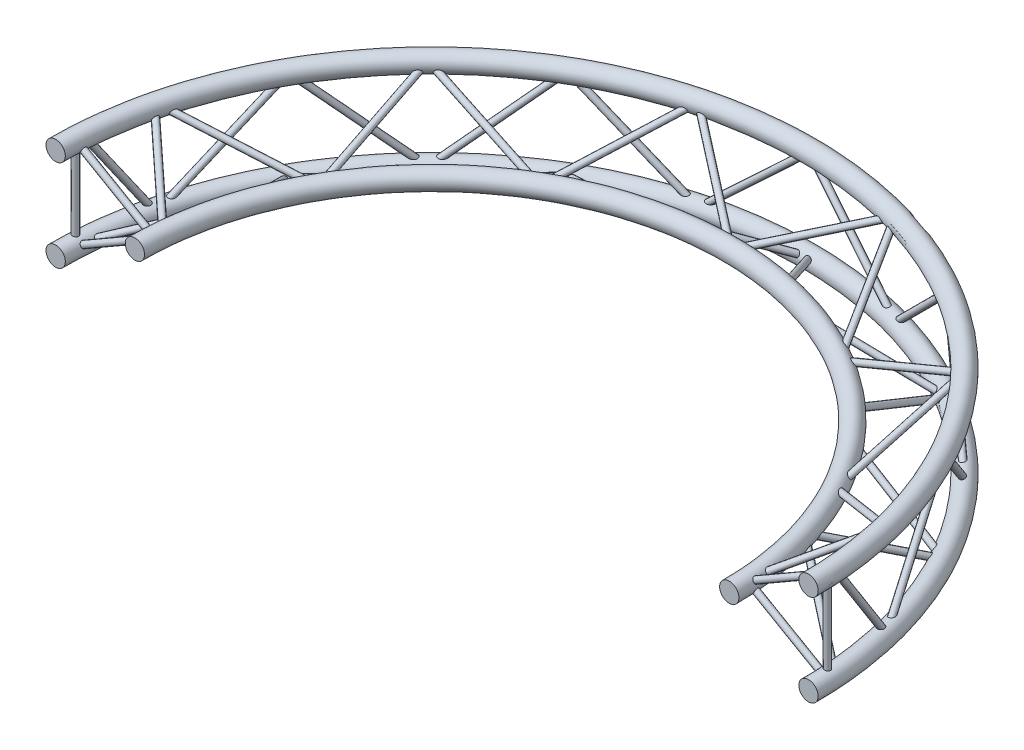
SolidWorks part; units mm, degrees
ref_plane "Face" through (0, 0, 0) normal (0, 0, 1) x (1, 0, 0)
ref_plane "Dessus" through (0, 0, 0) normal (0, 1, 0) x (1, 0, 0)
ref_plane "Droite" through (0, 0, 0) normal (1, 0, 0) x (0, 0, -1)
sketch "Esquisse1" plane through (0, 0, 0) normal (0, 0, 1) x (1, 0, 0)
  line L0 (975, 118.5) -> (769.752, 0) construction
  line L1 (769.752, 0) -> (975, -118.5) construction
  line L2 (975, -118.5) -> (975, 118.5) construction
  line L3 (906.584, 61.5908) -> (906.584, -61.5908) construction
  line L4 (72.9361, 0) -> (1740.2318, 0) construction
  line L5 (906.584, 0) -> (975, 118.5)
  line L8 (1000, -118.5) -> (1000, 157.8926) construction
  line L9 (0, 252.4415) -> (0, -235.2114) construction
  circle A0 centre (906.584, 0) radius 136.832 construction
  circle A1 centre (975, 118.5) radius 25
  circle A2 centre (769.752, 0) radius 25
  circle A3 centre (975, -118.5) radius 25
  dimension "D1" = 60
  dimension "D2" = 50
  dimension "D3" = 237
  dimension "D4" = 1000
revolve "Révolution1" add sketch "Esquisse1" angle 180 about L9
ref_point "Point1"
ref_plane "Plan1" through (0, 0, 0) normal (0, 1, 0) x (-1, 0, 0)
sketch "cercle1" plane through (0, 0, 0) normal (0, 1, 0) x (-1, 0, 0)
  circle A0 centre (0, 0) radius 769.752
ref_point "Point2"
ref_plane "Plan2" through (0, -118.5, 0) normal (0, 1, 0) x (-1, 0, 0)
sketch "cercle2" plane through (0, -118.5, 0) normal (0, 1, 0) x (-1, 0, 0)
  circle A0 centre (0, 0) radius 975
ref_point "Point3"
ref_plane "Plan3" through (0, 118.5, 0) normal (0, 1, 0) x (-1, 0, 0)
sketch "cercle3" plane through (0, 118.5, 0) normal (0, 1, 0) x (-1, 0, 0)
  circle A0 centre (0, 0) radius 975
ref_point "Point4"
ref_plane "Plan4" through (0, 0, 0) normal (0, 1, 0) x (-1, 0, 0)
sketch "cercle4" plane through (0, 0, 0) normal (0, 1, 0) x (-1, 0, 0)
  circle A0 centre (0, 0) radius 906.584
ref_plane "plan_sym" through (0, 0, 0) normal (1, 0, 0) x (0, 0, -1)
sketch3d "Esquisse3D1"
  line L0 (973.7179, 118.5, -49.9836) -> (768.1268, 0, -49.9934)
  line L1 (768.1268, 0, -49.9934) -> (973.7179, -118.5, -49.9836)
  line L2 (973.7179, -118.5, -49.9836) -> (973.7179, 118.5, -49.9836)
  line L3 (769.752, 0, 0) -> (975, -118.5, 0) construction
  circle A0 centre (0, 118.5, 0) radius 975 construction
  circle A1 centre (0, 0, 0) radius 769.752 construction
  circle A2 centre (0, -118.5, 0) radius 975 construction
  circle A3 centre (975, 118.5, 0) radius 25 construction
  point P4 (0, 1093.5, 0)
  point P7 (0, 769.752, 0)
  point P11 (0, 856.5, 0)
  point P14 (975, 118.5, 25)
  dimension "D1" = 50
  dimension "D2" = 50
  dimension "D3" = 50
ref_plane "Plan6" through (768.1268, 0, -49.9934) normal (-0.8664, -0.4994, 0) x (0.4994, -0.8664, -0.0001)
sketch "Esquisse8" plane through (768.1268, 0, -49.9934) normal (-0.8664, -0.4994, 0) x (0.4994, -0.8664, -0.0001)
  circle A0 centre (0, 0) radius 8
sweep "treilli droit départ" add profiles "Esquisse8" path "Esquisse3D1"
mirror "treilli droit fin" about plane through (0, 0, 0) normal (1, 0, 0) of "treilli droit départ"
sketch3d "Esquisse3D2"
  line L0 (972.4872, -118.5, -69.9549) -> (734.5482, 0, -230.1241)
  line L1 (769.752, 0, 0) -> (975, -118.5, 0) construction
  circle A0 centre (0, -118.5, 0) radius 975 construction
  circle A1 centre (0, 0, 0) radius 769.752 construction
  point P4 (0, 856.5, 0)
  point P7 (0, 769.752, 0)
  dimension "D1" = 70
  dimension "D2" = 230.7963
ref_plane "Plan7" through (734.5482, 0, -230.1241) normal (-0.7667, 0.3818, -0.5161) x (-0.5576, 0.0022, 0.8301)
sketch "Esquisse9" plane through (734.5482, 0, -230.1241) normal (-0.7667, 0.3818, -0.5161) x (-0.5576, 0.0022, 0.8301)
  circle A0 centre (0, 0) radius 8
  dimension "D1" = 16
sweep "treilli depart 1" add profiles "Esquisse9" path "Esquisse3D2"
sketch3d "Esquisse3D3"
  line L0 (766.5691, 0, -69.9276) -> (947.6836, 118.5, -229.1741)
  circle A0 centre (0, 0, 0) radius 769.752 construction
  circle A1 centre (0, 118.5, 0) radius 975 construction
  point P4 (0, 769.752, 0)
  point P7 (0, 1093.5, 0)
  dimension "D1" = 70
  dimension "D2" = 230.7963
ref_plane "Plan8" through (766.5691, 0, -69.9276) normal (0.674, 0.441, -0.5926) x (-0.7281, 0.5323, -0.4319)
sketch "Esquisse10" plane through (766.5691, 0, -69.9276) normal (0.674, 0.441, -0.5926) x (-0.7281, 0.5323, -0.4319)
  circle A0 centre (0, 0) radius 8
  dimension "D1" = 16
sweep "treilli depart 2" add profiles "Esquisse10" path "Esquisse3D3"
sketch3d "Esquisse3D4"
  line L0 (972.4872, 118.5, -69.9549) -> (947.6836, -118.5, -229.1741)
  circle A0 centre (0, 118.5, 0) radius 975 construction
  circle A1 centre (0, -118.5, 0) radius 975 construction
  point P4 (0, 1093.5, 0)
  point P7 (0, 856.5, 0)
  dimension "D1" = 230.7963
  dimension "D2" = 70
ref_plane "Plan9" through (947.6836, -118.5, -229.1741) normal (-0.0865, -0.827, -0.5556) x (0.9956, -0.0518, -0.0781)
sketch "Esquisse11" plane through (947.6836, -118.5, -229.1741) normal (-0.0865, -0.827, -0.5556) x (0.9956, -0.0518, -0.0781)
  circle A0 centre (0, 0) radius 8
  dimension "D1" = 16
sweep "treilli depart 3" add profiles "Esquisse11" path "Esquisse3D4"
mirror "treillis fin" about plane through (0, 0, 0) normal (1, 0, 0) of "treilli depart 1", "treilli depart 2", "treilli depart 3"
sketch3d "Esquisse3D6"
  line L0 (947.6836, 118.5, -229.1741) -> (674.3665, 0, -371.1441)
  line L1 (927.0673, 105.0111, -211.047) -> (785.4341, 12.343, -86.5148) construction
  circle A0 centre (0, 118.5, 0) radius 975 construction
  circle A1 centre (0, 0, 0) radius 769.752 construction
  point P4 (0, 1093.5, 0)
  point P7 (0, 769.752, 0)
  dimension "D1" = 330
ref_plane "Plan11" through (674.3665, 0, -371.1441) normal (-0.8282, -0.3591, -0.4302) x (0.5565, -0.6174, -0.556)
sketch "Esquisse12" plane through (674.3665, 0, -371.1441) normal (-0.8282, -0.3591, -0.4302) x (0.5565, -0.6174, -0.556)
  circle A0 centre (0, 0) radius 8
  dimension "D1" = 16
sweep "treilli int 1" add profiles "Esquisse12" path "Esquisse3D6"
ref_plane "Plan10" through (0, 0, 0) normal (0.4822, 0, 0.8761) x (0.8761, 0, -0.4822)
sketch3d "Esquisse3D7"
  line L2 (947.4717, -118.5, -230.0487) -> (854.1807, 118.5, -470.1066)
  circle A0 centre (0, 118.5, 0) radius 975 construction
  circle A1 centre (0, -118.5, 0) radius 975 construction
  point P4 (0, 1093.5, 0)
  point P5 (0, 856.5, 0)
  dimension "D1" = 350
ref_plane "Plan12" through (854.1807, 118.5, -470.1066) normal (-0.2665, 0.6771, -0.6859) x (-0.9638, -0.1787, 0.1981)
sketch "Esquisse13" plane through (854.1807, 118.5, -470.1066) normal (-0.2665, 0.6771, -0.6859) x (-0.9638, -0.1787, 0.1981)
  circle A0 centre (0, 0) radius 8
  dimension "D1" = 16
sweep "treilli int 2" add profiles "Esquisse13" path "Esquisse3D7"
sketch3d "Esquisse3D9"
  line L0 (734.5482, 0, -230.1241) -> (854.1807, -118.5, -470.1066)
  line L1 (953.3141, -108.9513, -82.8613) -> (767.6169, -16.4691, -207.8639) construction
  circle A0 centre (0, 0, 0) radius 769.752 construction
  circle A1 centre (0, -118.5, 0) radius 975 construction
  point P4 (0, 769.752, 0)
  point P7 (0, 856.5, 0)
  dimension "D1" = 293.1652
ref_plane "Plan13" through (734.5482, 0, -230.1241) normal (0.4081, -0.4042, -0.8186) x (-0.8857, 0.0423, -0.4624)
sketch "Esquisse14" plane through (734.5482, 0, -230.1241) normal (0.4081, -0.4042, -0.8186) x (-0.8857, 0.0423, -0.4624)
  circle A0 centre (0, 0) radius 8
  dimension "D1" = 16
sweep "treilli int 3" add profiles "Esquisse14" path "Esquisse3D9"
sketch3d "Esquisse3D10"
  line L0 (700.6628, 118.5, -678.0093) -> (674.3665, 0, -371.1441)
  circle A0 centre (0, 118.5, 0) radius 975 construction
  circle A1 centre (0, 0, 0) radius 769.752 construction
  point P4 (0, 1093.5, 0)
  point P7 (0, 769.752, 0)
  dimension "D1" = 330
ref_plane "Plan14" through (700.6628, 118.5, -678.0093) normal (-0.0797, -0.3591, 0.9299) x (0.996, 0.0091, 0.0888)
sketch "Esquisse15" plane through (700.6628, 118.5, -678.0093) normal (-0.0797, -0.3591, 0.9299) x (0.996, 0.0091, 0.0888)
  circle A0 centre (0, 0) radius 8
  dimension "D1" = 16
sweep "treilli int4" add profiles "Esquisse15" path "Esquisse3D10"
sketch3d "Esquisse3D11"
  line L0 (854.1807, 118.5, -470.1066) -> (701.2883, -118.5, -677.3623)
  circle A0 centre (0, -118.5, 0) radius 975 construction
  point P5 (0, 856.5, 0)
  dimension "D1" = 350
ref_plane "Plan15" through (701.2883, -118.5, -677.3623) normal (-0.4368, -0.6771, -0.5922) x (-0.8972, 0.3752, 0.2328)
sketch "Esquisse16" plane through (701.2883, -118.5, -677.3623) normal (-0.4368, -0.6771, -0.5922) x (-0.8972, 0.3752, 0.2328)
  circle A0 centre (0, 0) radius 8
  dimension "D1" = 16
sweep "treilli int 5" add profiles "Esquisse16" path "Esquisse3D11"
sketch3d "Esquisse3D12"
  line L0 (854.1807, -118.5, -470.1066) -> (587.429, 0, -497.4388)
  circle A0 centre (0, 0, 0) radius 769.752 construction
  point P5 (0, 769.752, 0)
  dimension "D1" = 293.1652
ref_plane "Plan16" through (854.1807, -118.5, -470.1066) normal (-0.9099, 0.4042, -0.0932) x (-0.1406, -0.0891, 0.986)
sketch "Esquisse17" plane through (854.1807, -118.5, -470.1066) normal (-0.9099, 0.4042, -0.0932) x (-0.1406, -0.0891, 0.986)
  circle A0 centre (0, 0) radius 8
  dimension "D1" = 16
sweep "treilli int 6" add profiles "Esquisse17" path "Esquisse3D12"
sketch "Esquisse19" plane through (0, 0, 0) normal (0, 1, 0) x (1, 0, 0)
  line L0 (674.3665, 371.1441) -> (0, 0)
  line L1 (0, 0) -> (947.6836, 229.1741)
  line L2 (927.0673, 211.047) -> (785.4341, 86.5148) construction
  line L3 (-234.9734, -129.3199) -> (234.9734, 129.3199) construction
  line L4 (926.5748, 240.1387) -> (713.6413, 350.7435) construction
  circle A1 centre (0, 0) radius 769.752 construction
  circle A2 centre (0, 0) radius 975 construction
  dimension "D1" = 15.232
pattern_circular "Répétition circulaire1" count 5 every 30.464 of "treilli int 1", "treilli int 3", "treilli int 2"
pattern_circular "Répétition circulaire2" count 5 every 30.464 of "treilli int4", "treilli int 6", "treilli int 5"
sketch3d "Esquisse3D13"
  line L0 (-972.4839, 118.5, -70) -> (-734.3372, 0, -230.7963)
  circle A0 centre (0, 118.5, 0) radius 975 construction
  circle A1 centre (0, 0, 0) radius 769.752 construction
  point P4 (0, 1093.5, 0)
  point P7 (0, 769.752, 0)
  dimension "D1" = 230.7963
  dimension "D2" = 70
ref_plane "Plan17" through (-972.4839, 118.5, -70) normal (0.7662, -0.3812, -0.5173) x (0.6032, 0.7043, 0.3744)
sketch "Esquisse21" plane through (-972.4839, 118.5, -70) normal (0.7662, -0.3812, -0.5173) x (0.6032, 0.7043, 0.3744)
  circle A0 centre (0, 0) radius 8
  dimension "D1" = 16
sweep "treilli sym 1" [suppressed] add profiles "Esquisse21" path "Esquisse3D13"
sketch3d "Esquisse3D14"
  line L0 (-947.2898, 118.5, -230.7963) -> (-972.4839, -118.5, -70)
  circle A0 centre (0, 118.5, 0) radius 975 construction
  circle A1 centre (0, -118.5, 0) radius 975 construction
  point P4 (0, 1093.5, 0)
  point P7 (0, 856.5, 0)
  dimension "D1" = 70
  dimension "D2" = 230.7963
ref_plane "Plan18" [suppressed] through (-972.4839, -118.5, -70) normal (-0.0876, -0.8243, 0.5593) x (0.9543, 0.0916, 0.2845)
sketch "Esquisse22" [suppressed] plane through (-972.4839, -118.5, -70) normal (-0.0876, -0.8243, 0.5593) x (0.9543, 0.0916, 0.2845)
  circle A0 centre (-5.0885, 0) radius 8
  dimension "D1" = 16
sweep "treilli sym 2" [suppressed] add profiles "Esquisse22" path "Esquisse3D14"
sketch3d "Esquisse3D15"
  line L0 (-947.6836, -118.5, -229.1741) -> (-766.5625, 0, -70)
  circle A0 centre (0, -118.5, 0) radius 975 construction
  circle A1 centre (0, 0, 0) radius 769.752 construction
  circle A3 centre (-975, -118.5, 0) radius 25 construction
  point P4 (0, 856.5, 0)
  point P7 (0, 769.752, 0)
  point P13 (-975, -118.5, -25)
  dimension "D1" = 70
  dimension "D2" = 230.7963
ref_plane "Plan19" [suppressed] through (-947.6836, -118.5, -229.1741) normal (0.6741, 0.4411, 0.5925) x (0.7257, -0.5447, -0.4203)
sketch "Esquisse23" [suppressed] plane through (-947.6836, -118.5, -229.1741) normal (0.6741, 0.4411, 0.5925) x (0.7257, -0.5447, -0.4203)
  circle A0 centre (0, 0) radius 8
  dimension "D1" = 16
sweep "treilli sym 3" [suppressed] add profiles "Esquisse23" path "Esquisse3D15"
equation "\"D1@plan_sym\"=\"D1@Révolution1\"/2"
equation "\"pas_theorique\"=500"
equation "\"demi_pas_theorique\"=\"pas_theorique\"/2"
equation "\"nb_demi_pas_theorique\"=(2*\"D4@Esquisse1\"* pi -2*70)/(\"demi_pas_theorique\")"
equation "\"nb_arche\"=360/\"D1@Révolution1\""
equation "\"nb_demi_pas_th_2\"=\"nb_demi_pas_theorique\"/\"nb_arche\""
equation "\"nb_demi_pas_entier\"=int(\"nb_demi_pas_th_2\")-1"
equation "\"D2@Esquisse3D2\" = 70+(\"nb_demi_pas_th_2\"-\"nb_demi_pas_entier\")*\"pas_theorique\"/4"
equation "\"D2@Esquisse3D3\" = \"D2@Esquisse3D2\""
equation "\"D1@Esquisse3D4\"=\"D2@Esquisse3D2\""
equation "\"D1@Esquisse3D10\" = \"D1@Esquisse3D6\""
equation "\"D1@Esquisse3D11\" = \"D1@Esquisse3D7\""
equation "\"D1@Esquisse3D12\" = \"D1@Esquisse3D9\""
equation "\"D2@Répétition circulaire1\"=\"D1@Esquisse19\"*2"
equation "\"D1@Esquisse3D13\" = \"D2@Esquisse3D2\""
equation "\"D2@Esquisse3D14\" = \"D1@Esquisse3D4\""
equation "\"D2@Esquisse3D15\" = \"D2@Esquisse3D3\""
equation "\"D2@Répétition circulaire2\" = \"D1@Esquisse19\"*2"
